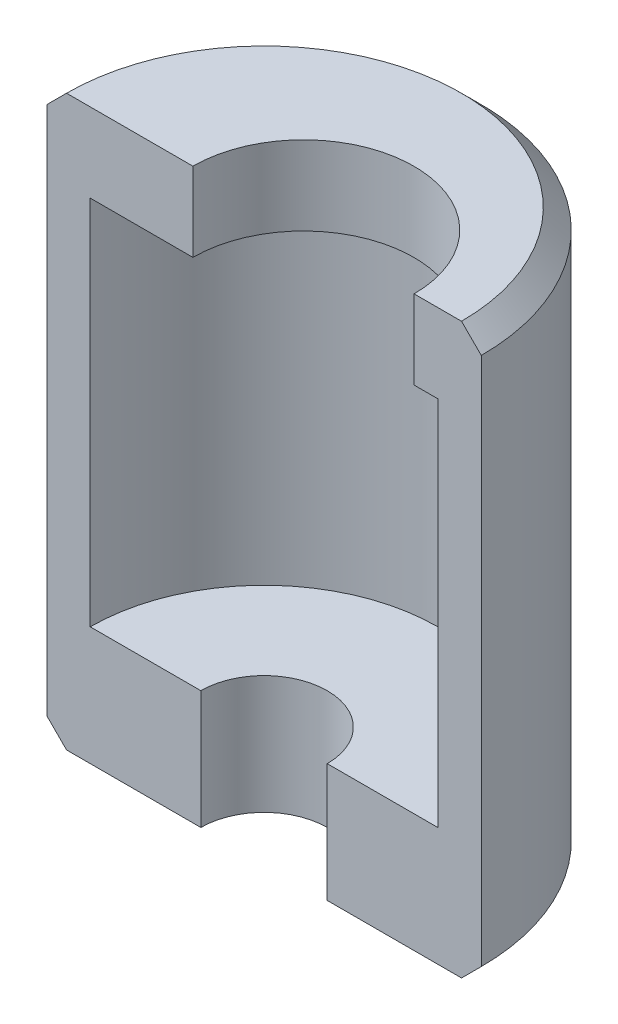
SolidWorks part; units mm, degrees
ref_plane "Plan1" through (0, 0, 0) normal (0, 0, 1) x (1, 0, 0)
ref_plane "Plan2" through (0, 0, 0) normal (0, 1, 0) x (1, 0, 0)
ref_plane "Plan3" through (0, 0, 0) normal (1, 0, 0) x (0, 0, -1)
sketch "Esquisse1" plane through (0, 0, 0) normal (0, 0, 1) x (1, 0, 0)
  line L1 (-16, -44) -> (-55, -44)
  line L2 (0, 80) -> (0, 100)
  line L3 (0, 100) -> (-55, 100)
  line L4 (-55, -44) -> (-55, 100)
  line L5 (0, 80) -> (-44, 80)
  line L7 (-44, 80) -> (-44, -14)
  line L8 (-44, -14) -> (-16, -14)
  line L9 (-16, -14) -> (-16, -44)
revolve "Révolution1" add sketch "Esquisse1" angle 360 about L2
sketch "Esquisse2" plane through (0, 100, 0) normal (0, 1, 0) x (-1, 0, 0)
  circle A0 centre (-9.9903, 0.0245) radius 28
  dimension "D2" = 56
extrude "Enlèv. mat.-Extru.1" cut sketch "Esquisse2" against normal up to next
chamfer "Chanfrein2" distance 5 angle 45
sketch "Esquisse3" plane through (0, 0, 0) normal (0, 0, 1) x (1, 0, 0)
  line L1 (-88.7983, 105.8714) -> (79.0768, 105.8714)
  line L2 (-88.7983, 105.8714) -> (-88.7983, -52.6824)
  line L3 (-88.7983, -52.6824) -> (79.0768, -52.6824)
  line L4 (79.0768, 105.8714) -> (79.0768, -52.6824)
extrude "Enlèv. mat.-Extru.2" cut sketch "Esquisse3" along normal through all
